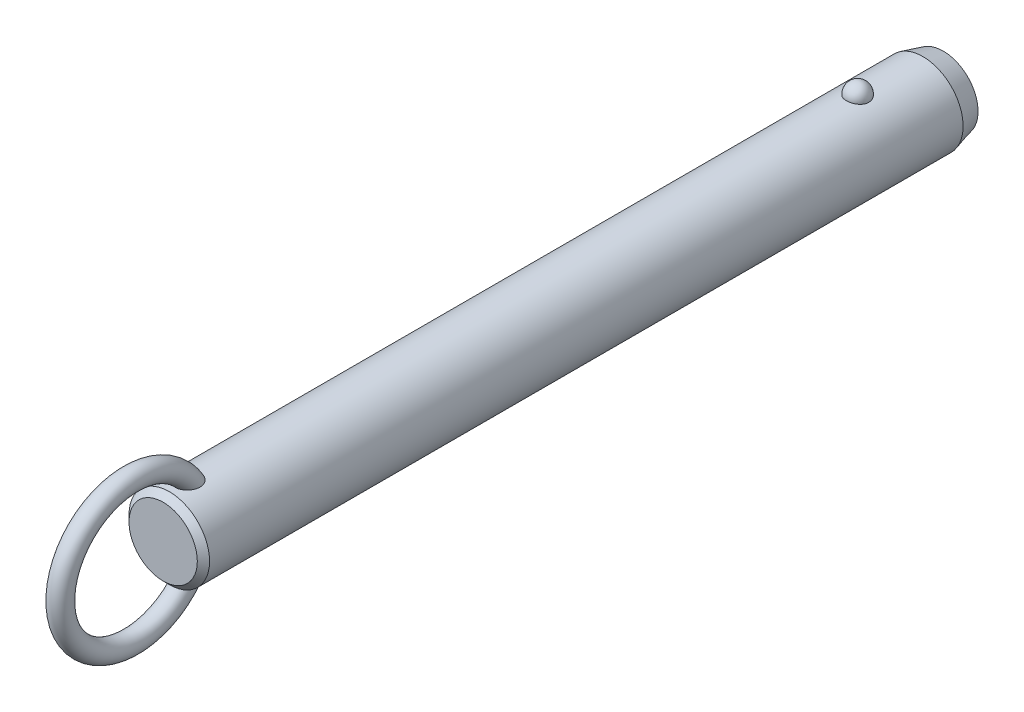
SolidWorks part; units mm, degrees
ref_plane "Front Plane" through (0, 0, 0) normal (0, 0, 1) x (1, 0, 0)
ref_plane "Top Plane" through (0, 0, 0) normal (0, 1, 0) x (1, 0, 0)
ref_plane "Right Plane" through (0, 0, 0) normal (1, 0, 0) x (0, 0, -1)
sketch "Sketch2" plane through (0, 0, 0) normal (0, 0, 1) x (1, 0, 0)
  circle A0 centre (0, 0) radius 7.9
  point P3 (0, 7.9)
  dimension "D1" = 15.8
extrude "Boss-Extrude1" add sketch "Sketch2" along normal blind 124.5
sketch "Sketch3" plane through (0, 0, 0) normal (0, 0, -1) x (-1, 0, 0)
  circle A0 centre (0, 0) radius 7.9
  dimension "D1" = 15.8
extrude "Boss-Extrude2" add sketch "Sketch3" along normal blind 19
chamfer "Chamfer1" distance 4 angle 15 1 edges at (-7.9, 0, -19)
sketch "Sketch12" plane through (0, 0, 0) normal (1, 0, 0) x (0, 0, -1)
  line L0 (-124.5, 7.9) -> (-124.5, -7.9) construction
  point P0 (-124.5, 0)
sketch "Sketch13" plane through (0, 0, 0) normal (1, 0, 0) x (0, 0, -1)
  circle A0 centre (-140.35, 0) radius 15.85
  point P2 (-124.5, 0)
  dimension "D1" = 31.7
sketch "Sketch14" plane through (0, 0, 0) normal (0, 1, 0) x (1, 0, 0)
  circle A0 centre (0, -126.5) radius 2
  point P2 (0, -124.5)
  dimension "D1" = 4
sweep "Sweep1" add profiles "Sketch14" path "Sketch13"
sketch "Sketch15" plane through (0, 0, 124.5) normal (0, 0, 1) x (1, 0, 0)
  circle A0 centre (0, 0) radius 7.9
  dimension "D1" = 15.8
extrude "Boss-Extrude3" add sketch "Sketch15" along normal blind 9.52
chamfer "Chamfer2" distance 1.2 angle 45 1 edges at (7.9, 0, 134.02)
sketch "Sketch18" plane through (0, 0, 0) normal (1, 0, 0) x (0, 0, -1)
  line L0 (15, 7.9) -> (-126.6091, 7.9) construction
  line L1 (2.2, 10.1) -> (2.2, 5.7)
  line L2 (-126.6091, -7.9) -> (15, -7.9) construction
  arc A0 (2.2, 10.1) -> (2.2, 5.7) centre (2.2, 7.9) ccw
  point P4 (0, 7.9)
  dimension "D1" = 18
revolve "Revolve1" add sketch "Sketch18" angle 360 about L1
